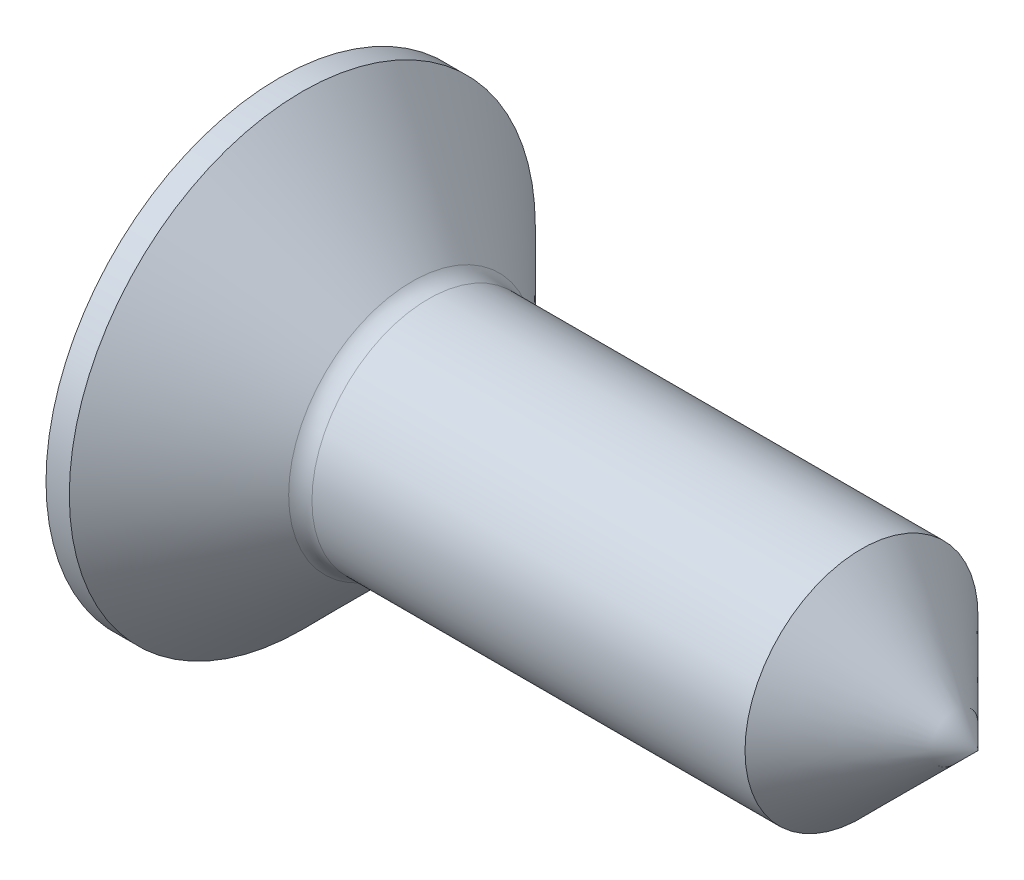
SolidWorks part; units mm, degrees
ref_plane "Front" through (0, 0, 0) normal (0, 0, 1) x (1, 0, 0)
ref_plane "Top" through (0, 0, 0) normal (0, 1, 0) x (1, 0, 0)
ref_plane "Right" through (0, 0, 0) normal (1, 0, 0) x (0, 0, -1)
sketch "Sketch1" plane through (0, 0, 0) normal (0, 1, 0) x (1, 0, 0)
  line L0 (-7.2405, 0) -> (8.2353, 0) construction
  line L1 (1.8, 1) -> (6.6, 1)
  line L2 (1.8, 1) -> (0.8, 2)
  line L3 (6.6, 1) -> (6.6, 0)
  line L4 (0.8, 2) -> (0.6, 2)
  line L5 (6.6, 0) -> (0, 0)
  arc A0 (0.6, 2) -> (0, 0) centre (3.6333, 0) ccw
  dimension "D1" = 45
  dimension "l" = 6
  dimension "d" = 2
  dimension "dk" = 4
  dimension "k" = 1.2
  dimension "f" = 0.6
revolve "Base" add sketch "Sketch1" angle 360 about L0
fillet "Fillet1" radius 0.2 1 edges at (1.8, 0, 1)
sketch "Sketch4" plane through (0, 0, 0) normal (0, 0, 1) x (1, 0, 0)
  line L0 (4.6467, 0) -> (7.1195, 0) construction
  line L2 (7.21, 0) -> (7.21, 20)
  line L3 (7.21, 20) -> (-13.4, 20)
  line L4 (-13.4, 20) -> (6.6, 0)
  line L5 (6.6, 0) -> (7.21, 0)
  line L6 (6.6, -1) -> (6.6, 1) construction
  dimension "D1" = 45
  dimension "D2" = 20
  dimension "D3" = 0.61
revolve "Cut-Revolve1" cut sketch "Sketch4" angle 360 about L0
sketch "Sketch3" plane through (0, 0, 0) normal (1, 0, 0) x (0, 0, -1)
  line L0 (2.315, 0) -> (-2.7642, 0) construction
  line L2 (0, 2.5823) -> (0, -2.9096) construction
  line L3 (-0.3375, 0.3375) -> (-1.35, 0.3375)
  line L4 (0.3375, -1.35) -> (-0.3375, -1.35)
  line L5 (0.3375, -1.35) -> (0.3375, -0.3375)
  line L6 (0.3375, 1.35) -> (-0.3375, 1.35)
  line L7 (-0.3375, -1.35) -> (-0.3375, -0.3375)
  line L8 (1.35, 0.3375) -> (0.3375, 0.3375)
  line L9 (1.35, 0.3375) -> (1.35, -0.3375)
  line L10 (1.35, -0.3375) -> (0.3375, -0.3375)
  line L11 (-1.35, 0.3375) -> (-1.35, -0.3375)
  line L12 (-0.3375, -0.3375) -> (-1.35, -0.3375)
  line L13 (-0.3375, 0.3375) -> (-0.3375, 1.35)
  line L14 (0.3375, 0.3375) -> (0.3375, 1.35)
  point P4 (-0.3375, 0.3375)
  point P26 (0.3375, 0.3375)
  dimension "m" = 2.7
  dimension "D2" = 2.7
  dimension "D3" = 0.675
  dimension "D4" = 0.675
ref_plane "Plane1" through (1.65, 0, 0) normal (1, 0, 0) x (0, 0, -1)
sketch "Sketch6" plane through (1.65, 0, 0) normal (1, 0, 0) x (0, 0, -1)
  point P0 (0, 0)
loft "Cut-Loft1" cut profiles "Sketch3", "Sketch6"
sketch "Sketch7" plane through (0, 0, 0) normal (0, 0, 1) x (1, 0, 0)
  line L0 (2.6, 1.2) -> (2.85, 1.2)
  line L1 (2.85, 1.2) -> (2.85, 1)
  line L2 (2.85, 1) -> (2.725, 0.7835)
  line L3 (2.6, 1) -> (2.725, 0.7835)
  line L4 (2.6, 1.2) -> (2.6, 1)
  line L5 (10.7743, 0) -> (0, 0) construction
  line L6 (2.6, 1) -> (2.85, 1) construction
  line L7 (2.725, 1) -> (2.725, 0.7835) construction
  line L8 (5.6, 1) -> (1.8828, 1) construction
  point P5 (2.725, 1.2)
  dimension "D1" = 0.2
  dimension "D2" = 0.25
  dimension "D3" = 4
revolve "Cut-Revolve10" [suppressed] cut sketch "Sketch7" angle 360 about L5
pattern_linear "LPattern10" [suppressed] count 8 spacing 0.5 along (1, 0, 0)
equation "\"D4@Sketch3\" = \"m@Sketch3\" / 4"
equation "\"D2@Sketch3\" = \"m@Sketch3\""
equation "\"D3@Sketch3\" = \"m@Sketch3\" / 4"
equation "\"D1@Plane1\" = \"k@Sketch1\" + \"f@Sketch1\"  -  0.15"
equation "\"D2@Sketch7\" = (  \"d@Sketch1\" - \"D2@ThreadCosmetic1\" )  / 2"
equation "\"D3@Sketch7\" = \"D1@ThreadCosmetic1\" + \"d@Sketch1\" / 2"
equation "\"D3@LPattern10\" = \"D2@Sketch7\" *2"
equation "\"D1@LPattern10\" = \"D3@Sketch7\" / \"D3@LPattern10\""
